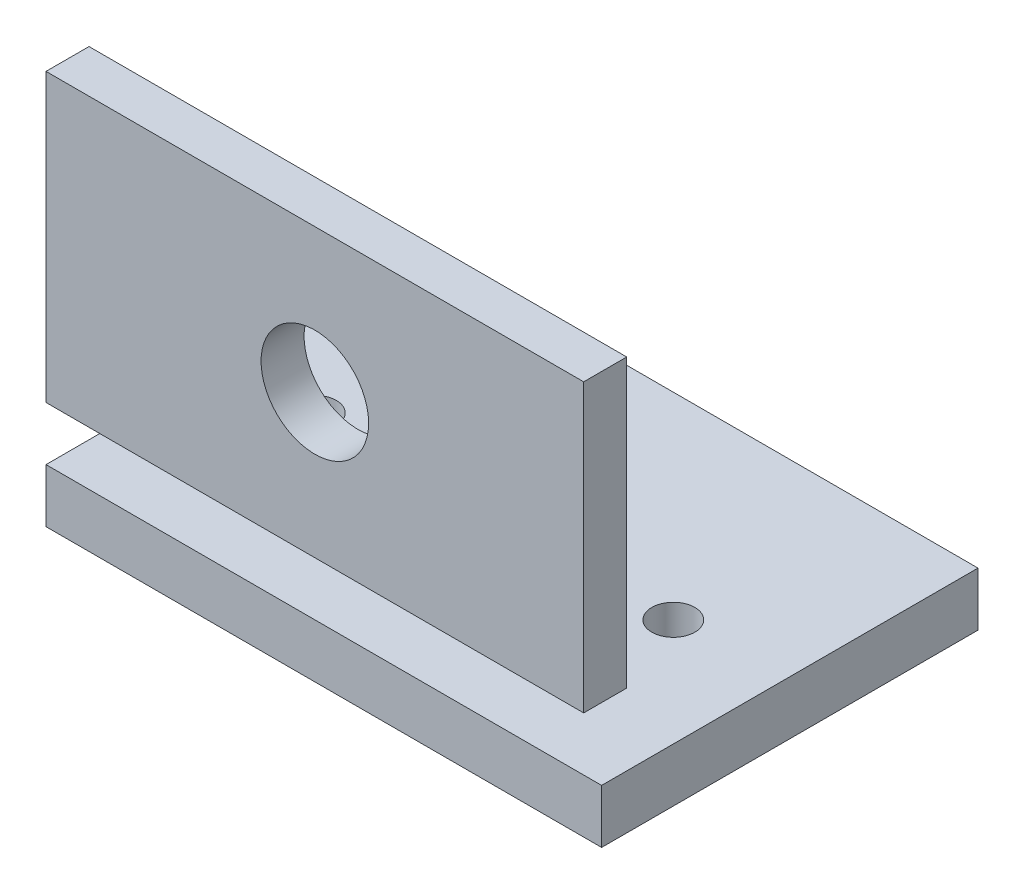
SolidWorks part; units mm, degrees
ref_plane "前视基准面" through (0, 0, 0) normal (0, 0, 1) x (1, 0, 0)
ref_plane "上视基准面" through (0, 0, 0) normal (0, 1, 0) x (1, 0, 0)
ref_plane "右视基准面" through (0, 0, 0) normal (1, 0, 0) x (0, 0, -1)
other "Configuration Table"
sketch "BaseSketch" plane through (0, 0, 0) normal (0, 1, 0) x (1, 0, 0)
  line L1 (0, 0) -> (155, 0)
  line L2 (0, 0) -> (0, 105)
  line L3 (0, 105) -> (155, 105)
  line L4 (155, 0) -> (155, 105)
  dimension "D1" = 155
  dimension "D2" = 105
extrude "BaseBoss" add sketch "BaseSketch" against normal blind 15
sketch "MountHolesSketch" plane through (0, 0, 0) normal (0, 1, 0) x (1, 0, 0)
  line L0 (25, 50) -> (125, 50) construction
  circle A0 centre (25, 50) radius 6
  circle A1 centre (125, 50) radius 6
  dimension "D2" = 12
  dimension "D3" = 12
  dimension "D1" = 100
extrude "MountHolesCut" cut sketch "MountHolesSketch" against normal blind 15
sketch "UprightSketch" plane through (0, 0, 0) normal (0, 0, 1) x (1, 0, 0)
  line L1 (0, 15) -> (150, 15)
  line L2 (0, 15) -> (0, 95)
  line L3 (0, 95) -> (150, 95)
  line L4 (150, 15) -> (150, 95)
  dimension "D1" = 80
extrude "UprightBoss" add sketch "UprightSketch" against normal blind 12
sketch "ShaftBoreSketch" plane through (0, 0, 0) normal (0, 0, 1) x (1, 0, 0)
  circle A0 centre (75, 55) radius 15
  dimension "D1" = 30
extrude "ShaftBoreCut" cut sketch "ShaftBoreSketch" against normal blind 12
